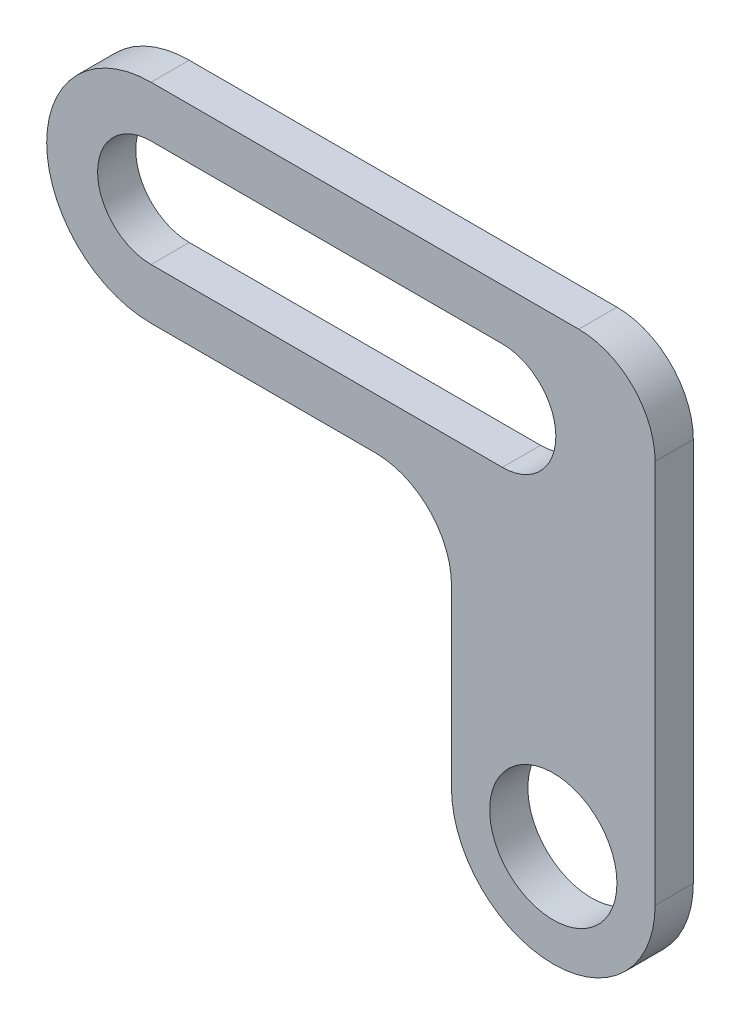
SolidWorks part; units mm, degrees
ref_plane "Plan de face" through (0, 0, 0) normal (0, 0, 1) x (1, 0, 0)
ref_plane "Plan de dessus" through (0, 0, 0) normal (0, 1, 0) x (1, 0, 0)
ref_plane "Plan de droite" through (0, 0, 0) normal (1, 0, 0) x (0, 0, -1)
sketch "Esquisse1" plane through (0, 0, 0) normal (0, 0, 1) x (1, 0, 0)
  line L1 (40, 0) -> (40, 181)
  line L2 (40, 181) -> (-158, 181)
  line L4 (-158, 99) -> (-40, 99)
  line L5 (-40, 99) -> (-40, 0)
  line L7 (-158, 161) -> (-20, 161)
  line L9 (-158, 119) -> (-20, 119)
  circle A0 centre (0, 0) radius 25
  arc A1 (-20, 119) -> (-20, 161) centre (-20, 140) ccw
  arc A2 (-158, 161) -> (-158, 119) centre (-158, 140) ccw
  arc A3 (-158, 181) -> (-158, 99) centre (-158, 140) ccw
  arc A4 (-40, 0) -> (40, 0) centre (0, 0) ccw
  dimension "D4" = 50
  dimension "D1" = 42
  dimension "D2" = 20
  dimension "D3" = 140
  dimension "D5" = 20
  dimension "D7" = 138
  dimension "D8" = 60
extrude "Boss.-Extru.1" add sketch "Esquisse1" along normal blind 15
fillet "Congé1" radius 30 2 edges at (-40, 99, 7.5) (40, 181, 7.5)
